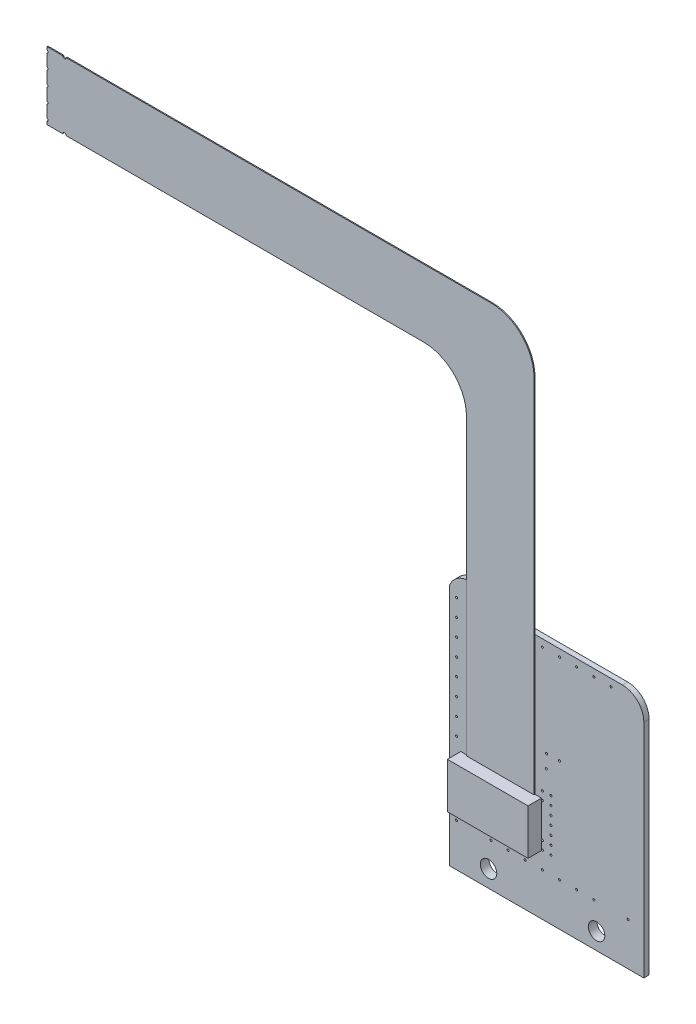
SolidWorks part; units mm, degrees
other "<100221168ra_esp_3g_flexboard>-<100221168ra_esp_3g_flexboard_idf-1-solid1>"
ref_plane "Front Plane" through (0, 0, 0) normal (0, 0, 1) x (1, 0, 0)
ref_plane "Top Plane" through (0, 0, 0) normal (0, 1, 0) x (1, 0, 0)
ref_plane "Right Plane" through (0, 0, 0) normal (1, 0, 0) x (0, 0, -1)
imported_body "100221166rc_esp_3gheaterboard-1-solid1"
imported_body "MBARI_ESPHEATERFLEXSMD2_7P_CON12_1_MBARI_ESPHEATERFLEXSMD-1-solid1"
imported_body "TRXDFN62X62X423N_MMBT3904FZ7B-1-solid1"
sketch "Sketch1" plane through (0, 0, 0) normal (0, 0, -1) x (-1, 0, 0)
  line L0 (0, 0) -> (-28.746, 0) construction
  line L1 (-26.162, 4.572) -> (-2.54, 4.572)
  line L2 (-26.162, 4.572) -> (-26.162, 0)
  line L3 (-26.162, 0) -> (-2.54, 0)
  line L4 (-2.54, 4.572) -> (-2.54, 0)
  line L5 (0, 36.0693) -> (0, 0) construction
  circle A0 centre (-21.746, 2.5) radius 1.2192 construction
  circle A1 centre (-21.746, 2.5) radius 1.2192
  circle A2 centre (-5.746, 2.5) radius 1.2192 construction
  circle A3 centre (-5.746, 2.5) radius 1.2192
  dimension "D1" = 4.572
  dimension "D2" = 23.622
  dimension "D3" = 2.54
extrude "Boss-Extrude1" add sketch "Sketch1" along normal blind 0.508
inserted part "100221168ra_esp_3g_flexboard"
move or copy body "Body-Move/Copy2" placed by mates yes
other "Distance1" parameters "D1"=65.405
other "Distance2" parameters "D1"=0.9712
